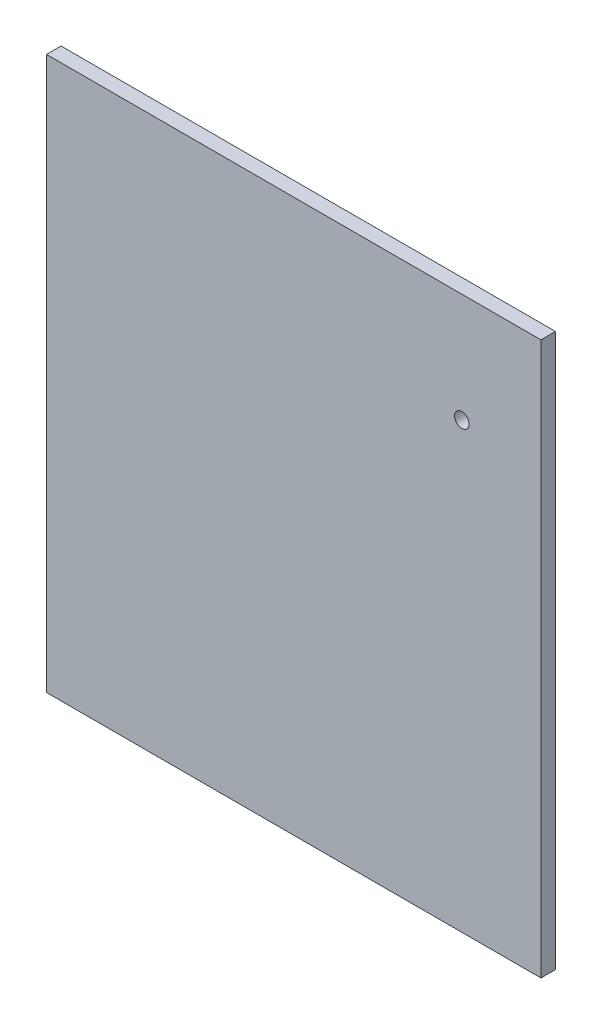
SolidWorks part; units mm, degrees
ref_plane "Front Plane" through (0, 0, 0) normal (0, 0, 1) x (1, 0, 0)
ref_plane "Top Plane" through (0, 0, 0) normal (0, 1, 0) x (1, 0, 0)
ref_plane "Right Plane" through (0, 0, 0) normal (1, 0, 0) x (0, 0, -1)
sketch "Sketch1" plane through (0, 0, 0) normal (0, 0, 1) x (1, 0, 0)
  line L1 (0, 0) -> (431.8, 0)
  line L2 (0, 0) -> (0, -482.6)
  line L3 (0, -482.6) -> (431.8, -482.6)
  line L4 (431.8, 0) -> (431.8, -482.6)
  dimension "D1" = 482.6
  dimension "D2" = 431.8
extrude "Boss-Extrude1" add sketch "Sketch1" along normal blind 12.7
sketch3d "3DSketch1" plane through (0, 0, 0) normal (0, 0, 1) x (1, 0, 0)
  dimension "D1" = 73.66
sketch "Sketch2" plane through (0, 0, 12.7) normal (0, 0, 1) x (1, 0, 0)
  circle A0 centre (362.7092, -95.1208) radius 6.35
  point P2 (362.7092, -95.1208)
  dimension "D1" = 12.7
extrude "Cut-Extrude1" cut sketch "Sketch2" against normal blind 35.56
